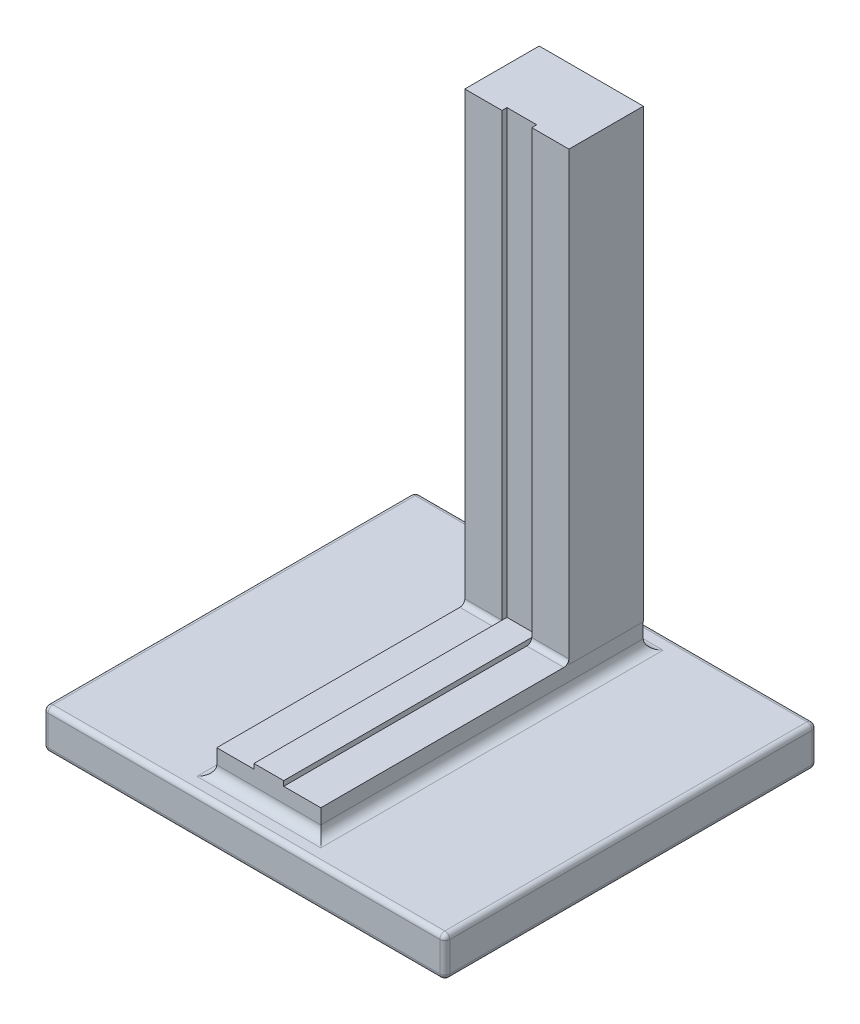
SolidWorks part; units mm, degrees
ref_plane "Plan de face" through (0, 0, 0) normal (0, 0, 1) x (1, 0, 0)
ref_plane "Plan de dessus" through (0, 0, 0) normal (0, 1, 0) x (1, 0, 0)
ref_plane "Plan de droite" through (0, 0, 0) normal (1, 0, 0) x (0, 0, -1)
sketch "Esquisse1" plane through (0, 0, 0) normal (0, 0, 1) x (1, 0, 0)
  line L1 (0, 0) -> (420, 0)
  line L2 (0, 0) -> (0, 1800)
  line L3 (0, 1800) -> (420, 1800)
  line L4 (420, 0) -> (420, 1800)
  dimension "D1" = 420
  dimension "D2" = 1800
extrude "Extrusion1" add sketch "Esquisse1" along normal blind 300
sketch "Esquisse2" plane through (0, 0, 300) normal (0, 0, 1) x (1, 0, 0)
  line L0 (420, 1800) -> (0, 1800) construction
  line L1 (150, 1800) -> (270, 1800)
  line L2 (150, 1800) -> (150, 0)
  line L3 (150, 0) -> (270, 0)
  line L4 (270, 1800) -> (270, 0)
  line L5 (0, 0) -> (420, 0) construction
  line L6 (0, 1800) -> (0, 0) construction
  dimension "D1" = 150
  dimension "D2" = 120
extrude "Enlèv. mat.-Extru.1" cut sketch "Esquisse2" against normal blind 20
sketch "Esquisse3" plane through (0, 0, 300) normal (0, 0, 1) x (1, 0, 0)
  line L1 (0, 0) -> (419.4799, 0)
  line L2 (0, 0) -> (0, -100)
  line L3 (0, -100) -> (419.4799, -100)
  line L4 (419.4799, 0) -> (419.4799, -100)
  dimension "D1" = 100
extrude "Extrusion2" add sketch "Esquisse3" along normal blind 1000 and the other way blind 300
sketch "Esquisse4" plane through (0, 0, 1300) normal (0, 0, 1) x (1, 0, 0)
  line L0 (270, 0) -> (270, 1800) construction
  line L1 (150, 0) -> (270, 0)
  line L2 (150, 0) -> (150, 20)
  line L3 (150, 20) -> (270, 20)
  line L4 (270, 0) -> (270, 20)
  dimension "D1" = 20
extrude "Extrusion3" add sketch "Esquisse4" against normal blind 1050
sketch "Esquisse5" plane through (0, -100, 0) normal (0, -1, 0) x (1, 0, 0)
  line L0 (0, 1300) -> (0, 0) construction
  line L1 (-600, 1400) -> (1019.4799, 1400)
  line L2 (-600, 1400) -> (-600, -100)
  line L3 (-600, -100) -> (1019.4799, -100)
  line L4 (1019.4799, 1400) -> (1019.4799, -100)
  line L5 (419.4799, 1300) -> (419.4799, 0) construction
  line L6 (0, 1300) -> (419.4799, 1300) construction
  line L7 (0, 0) -> (419.4799, 0) construction
  dimension "D1" = 600
  dimension "D2" = 600
  dimension "D3" = 100
  dimension "D4" = 100
extrude "Extrusion4" add sketch "Esquisse5" along normal blind 160
fillet "Congé4" radius 40 5 edges at (0, -100, 650) (209.74, -100, 0) (419.4799, -100, 650) (209.74, -100, 1300)
fillet "Congé5" radius 20 4 edges at (344.74, 0, 300) (270, 10, 300) (150, 10, 300)
fillet "Congé6" radius 20 12 edges at (-600, -100, 650) (-600, -180, 1400) (209.74, -100, -100) (-600, -180, -100) (1019.4799, -100, 650) (1019.4799, -180, -100) (209.74, -100, 1400) (1019.4799, -180, 1400) (-600, -260, 650) (209.74, -260, -100) (1019.4799, -260, 650) (209.74, -260, 1400)
